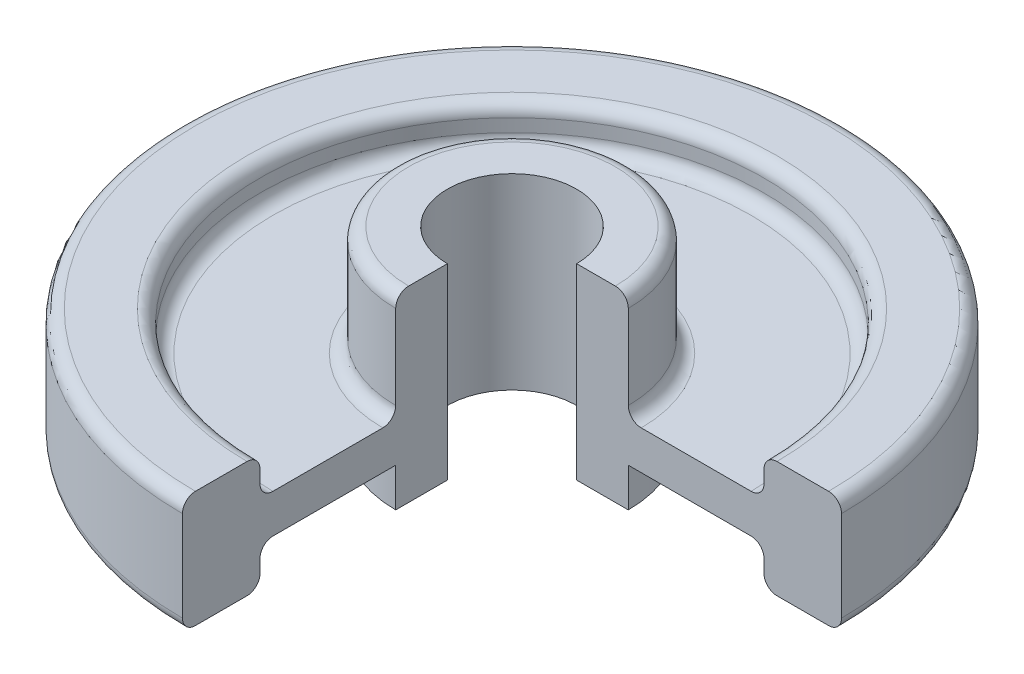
SolidWorks part; units mm, degrees
ref_plane "front" through (0, 0, 0) normal (0, 0, 1) x (1, 0, 0)
ref_plane "top" through (0, 0, 0) normal (0, 1, 0) x (1, 0, 0)
ref_plane "right" through (0, 0, 0) normal (1, 0, 0) x (0, 0, -1)
sketch "Sketch1" plane through (0, 0, 0) normal (0, 0, 1) x (1, 0, 0)
  line L0 (0, 0) -> (0, 73.4321) construction
  line L1 (0, 0) -> (80.9625, 0)
  line L2 (80.9625, 0) -> (80.9625, 28.575)
  line L3 (80.9625, 28.575) -> (28.575, 28.575)
  line L4 (28.575, 28.575) -> (28.575, 46.0502)
  line L5 (28.575, 46.0502) -> (0, 46.0502)
  line L6 (0, 46.0502) -> (0, 0)
  dimension "hub_hgt" = 46.0502
  dimension "rim_hgt" = 28.575
  dimension "D3" = 57.15
  dimension "D4" = 161.925
revolve "wheel" add sketch "Sketch1" angle 360 about L0
sketch "Sketch2" plane through (0, 46.0502, 0) normal (0, 1, 0) x (-1, 0, 0)
  circle A0 centre (0, 0) radius 15.875
  dimension "bore_diam" = 31.75
extrude "center_h" cut sketch "Sketch2" against normal through all
sketch "Sketch3" plane through (0, 0, 0) normal (0, 0, 1) x (1, 0, 0)
  line L0 (0, 0) -> (0, 57.8488) construction
  line L1 (0, 0) -> (0, 46.0502) construction
  line L2 (28.575, 28.575) -> (28.575, 46.0502) construction
  line L3 (28.575, 28.575) -> (28.575, 19.05)
  line L4 (28.575, 19.05) -> (61.9125, 19.05)
  line L5 (61.9125, 19.05) -> (61.9125, 28.575)
  line L6 (61.9125, 28.575) -> (28.575, 28.575)
  line L7 (80.9625, 28.575) -> (-80.9625, 28.575) construction
  dimension "upper_cut_depth" = 9.525
  dimension "D3" = 123.825
revolve "upper_cut" cut sketch "Sketch3" angle 360 about L0
sketch "Sketch4" plane through (0, 0, 0) normal (0, 0, 1) x (1, 0, 0)
  line L1 (28.575, 9.525) -> (28.575, 0)
  line L2 (28.575, 0) -> (61.9125, 0)
  line L3 (61.9125, 0) -> (61.9125, 9.525)
  line L4 (61.9125, 9.525) -> (28.575, 9.525)
  line L5 (-80.9625, 0) -> (80.9625, 0) construction
  line L7 (0, 0) -> (0, 56.4648) construction
  line L8 (0, 0) -> (0, 46.0502) construction
  line L19 (28.575, 28.575) -> (28.575, 46.0502) construction
  dimension "lower_cut_depth" = 9.525
  dimension "D3" = 123.825
revolve "lower_cut" cut sketch "Sketch4" angle 360 about L7
fillet "R.125" radius 3.175 8 edges at (0, 28.575, -61.9125) (0, 19.05, -61.9125) (0, 19.05, -28.575) (0, 0, -61.9125) (0, 9.525, -61.9125) (0, 46.0502, -28.575) (0, 28.575, -80.9625) (0, 0, -80.9625)
sketch "Sketch5" plane through (0, 46.0502, 0) normal (0, 1, 0) x (-1, 0, 0)
  line L1 (0, 0) -> (0, 80.9625)
  line L2 (0, 80.9625) -> (-80.9625, 80.9625)
  line L3 (-80.9625, 80.9625) -> (-80.9625, 0)
  line L4 (-80.9625, 0) -> (0, 0)
  circle A0 centre (0, 0) radius 80.9625 construction
extrude "cutaway" cut sketch "Sketch5" against normal through all
